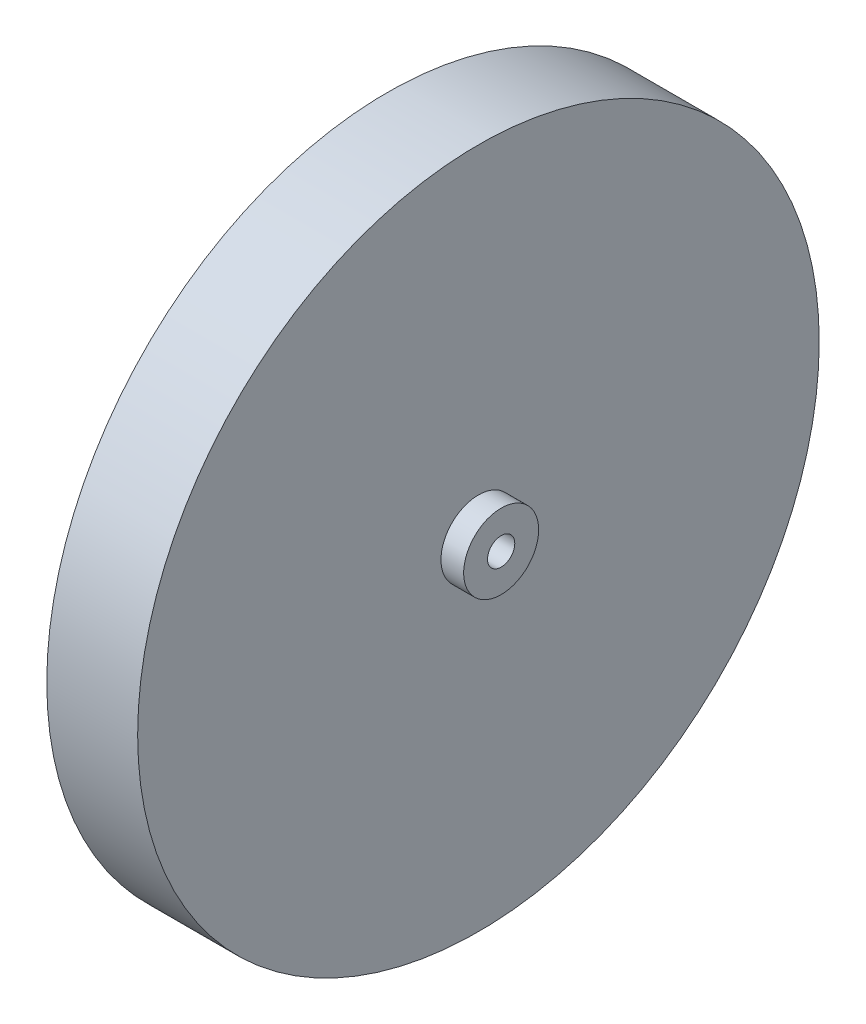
SolidWorks part; units mm, degrees
ref_plane "Front Plane" through (0, 0, 0) normal (0, 0, 1) x (1, 0, 0)
ref_plane "Top Plane" through (0, 0, 0) normal (0, 1, 0) x (1, 0, 0)
ref_plane "Right Plane" through (0, 0, 0) normal (1, 0, 0) x (0, 0, -1)
sketch "Sketch1" plane through (0, 0, 0) normal (1, 0, 0) x (0, 0, -1)
  circle A0 centre (0, 0) radius 38.1
  dimension "D1" = 76.2
extrude "Boss-Extrude1" add sketch "Sketch1" along normal blind 10.16
sketch "Sketch3" plane through (10.16, 0, 0) normal (1, 0, 0) x (0, 0, -1)
  circle A0 centre (0, 0) radius 4.191
  dimension "D1" = 8.382
extrude "Boss-Extrude2" add sketch "Sketch3" along normal blind 2.54
sketch "Sketch4" plane through (12.7, 0, 0) normal (1, 0, 0) x (0, 0, -1)
  circle A0 centre (0, 0) radius 1.524
  dimension "D1" = 3.048
extrude "Cut-Extrude1" cut sketch "Sketch4" against normal through all
equation "\"wheel\"= 0.4"
equation "\"D1@Boss-Extrude1\"=\"wheel\""
